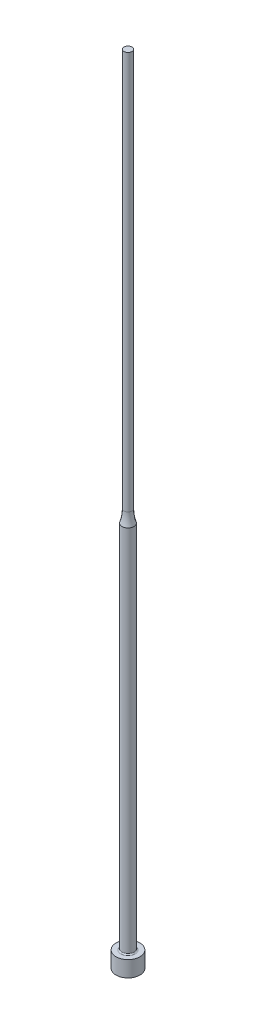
SolidWorks part; units mm, degrees
ref_plane "Front Plane" through (0, 0, 0) normal (0, 0, 1) x (1, 0, 0)
ref_plane "Top Plane" through (0, 0, 0) normal (0, 1, 0) x (1, 0, 0)
ref_plane "Right Plane" through (0, 0, 0) normal (1, 0, 0) x (0, 0, -1)
sketch "Sketch1" plane through (0, 0, 0) normal (0, 0, 1) x (1, 0, 0)
  line L0 (0, 0) -> (3, 0)
  line L1 (55, 0) -> (-55, 0) construction
  line L2 (3, 0) -> (3, 4)
  line L3 (3, 4) -> (1.8, 4)
  line L4 (1.5, 4.3) -> (1.5, 96.8775)
  line L6 (1, 100) -> (1, 200)
  line L7 (1, 200) -> (0, 200)
  line L8 (0, 200) -> (0, 0)
  arc A0 (1, 100) -> (1.5, 96.8775) centre (11, 100) ccw
  arc A1 (1.8, 4) -> (1.5, 4.3) centre (1.8, 4.3) cw
  dimension "D7" = 100
  dimension "D8" = 0.3
  dimension "D5" = 10
  dimension "D1" = 1
  dimension "D2" = 1.5
  dimension "D3" = 3
  dimension "D4" = 4
  dimension "D6" = 200
revolve "Revolve1" add sketch "Sketch1" angle 360 about L8
